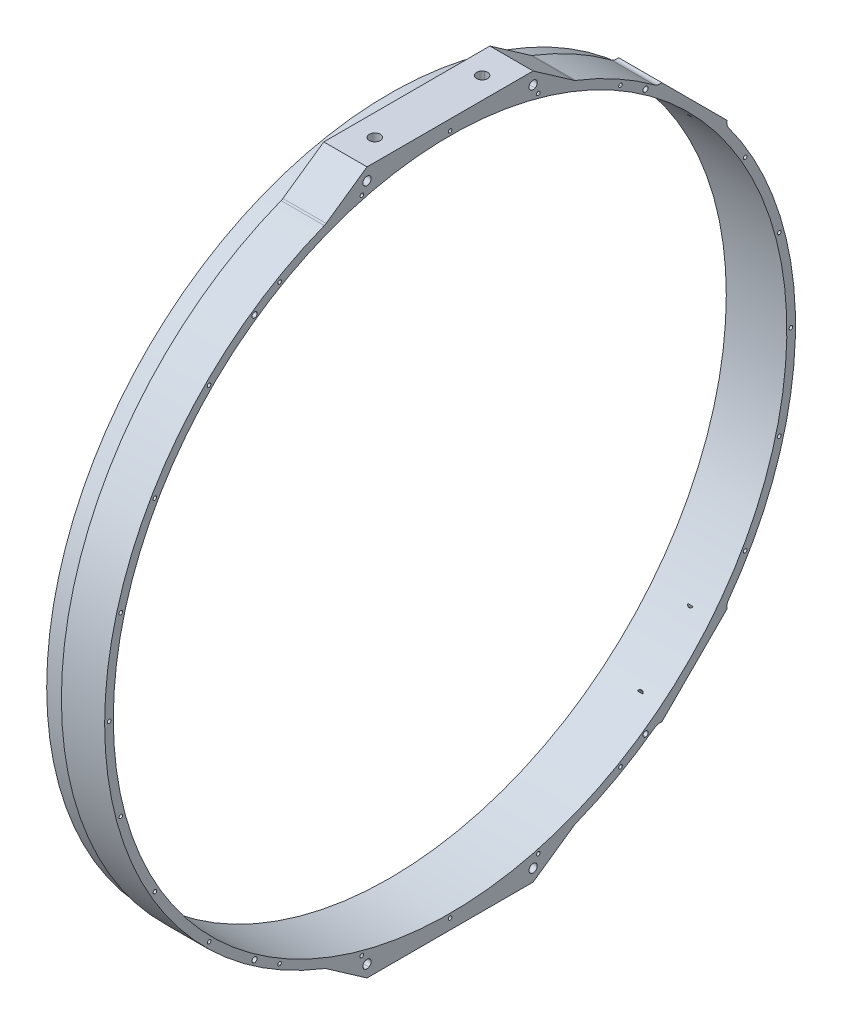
SolidWorks part; units mm, degrees
ref_plane "Front Plane" through (0, 0, 0) normal (0, 0, 1) x (1, 0, 0)
ref_plane "Top Plane" through (0, 0, 0) normal (0, 1, 0) x (1, 0, 0)
ref_plane "Right Plane" through (0, 0, 0) normal (1, 0, 0) x (0, 0, -1)
imported_body "Imported1"
sketch "Sketch5" plane through (0, 0, 0) normal (-1, 0, 0) x (0, 0, 1)
  arc A0 (186.6404, -341.6429) -> (-186.6404, 341.6429) centre (0, 0) ccw construction
  arc A1 (186.6404, -341.6429) -> (-186.6404, 341.6429) centre (0, 0) ccw
  arc A2 (-186.6404, 341.6429) -> (186.6404, -341.6429) centre (0, 0) ccw construction
  arc A3 (-186.6404, 341.6429) -> (186.6404, -341.6429) centre (0, 0) ccw
  circle A4 centre (0, 0) radius 396.3
  dimension "D1" = 7
extrude "Extrude1" add sketch "Sketch5" along normal blind 20
